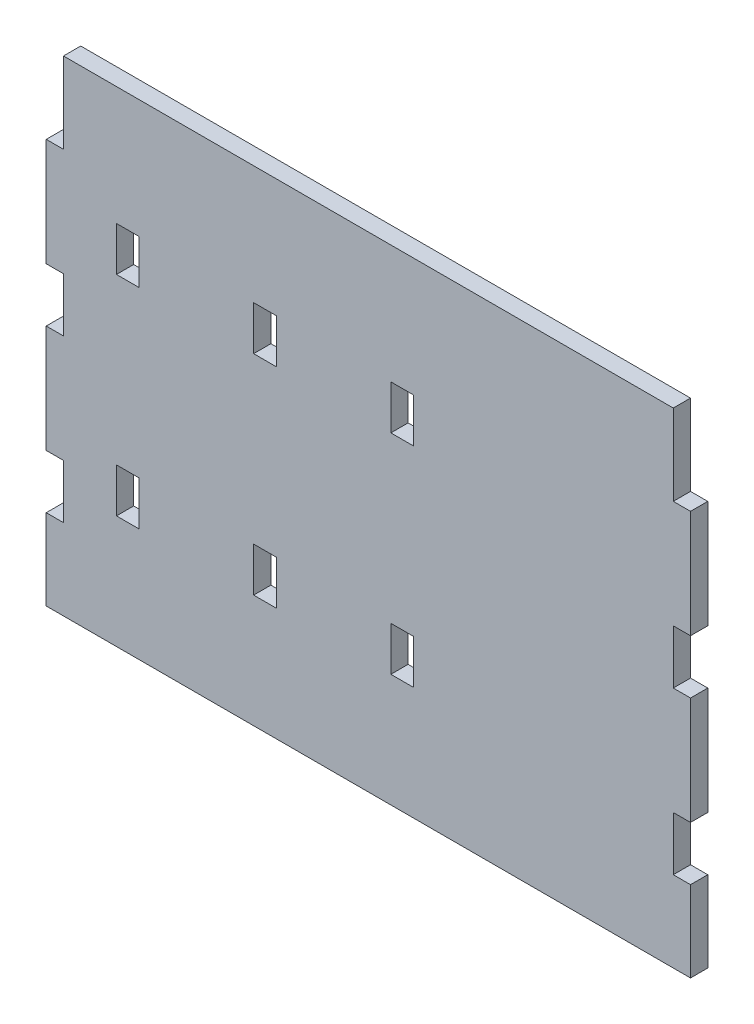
SolidWorks part; units mm, degrees
ref_plane "Front Plane" through (0, 0, 0) normal (0, 0, 1) x (1, 0, 0)
ref_plane "Top Plane" through (0, 0, 0) normal (0, 1, 0) x (1, 0, 0)
ref_plane "Right Plane" through (0, 0, 0) normal (1, 0, 0) x (0, 0, -1)
sketch "Sketch1" plane through (0, 0, 0) normal (0, 0, 1) x (1, 0, 0)
  line L0 (0, 550) -> (0, 475) construction
  line L2 (0, 100) -> (0, 550)
  line L3 (0, 550) -> (565.8, 550)
  line L4 (565.8, 100) -> (565.8, 550)
  line L5 (282.9, 550) -> (282.9, 100) construction
  line L6 (0, 375) -> (-16, 375)
  line L7 (450, 550) -> (450, 714.0497) construction
  line L8 (0, 475) -> (-16, 475)
  line L9 (-16, 375) -> (-16, 475)
  line L10 (-16, 175) -> (-16, 100)
  line L12 (0, 175) -> (0, 100)
  line L13 (0, 175) -> (-16, 175)
  line L14 (581.8, 225) -> (581.8, 325)
  line L15 (565.8, 325) -> (581.8, 325)
  line L16 (0, 225) -> (-16, 225)
  line L17 (0, 225) -> (0, 325)
  line L18 (0, 325) -> (-16, 325)
  line L19 (-16, 225) -> (-16, 325)
  line L20 (565.8, 225) -> (565.8, 325)
  line L21 (565.8, 225) -> (581.8, 225)
  line L22 (565.8, 175) -> (581.8, 175)
  line L23 (565.8, 175) -> (565.8, 100)
  line L25 (581.8, 175) -> (581.8, 100)
  line L26 (581.8, 375) -> (581.8, 475)
  line L27 (565.8, 475) -> (581.8, 475)
  line L28 (565.8, 375) -> (581.8, 375)
  line L30 (-16, 100) -> (581.8, 100)
extrude "Boss-Extrude1" add sketch "Sketch1" along normal blind 16
sketch "Sketch2" plane through (0, 0, 16) normal (0, 0, 1) x (1, 0, 0)
  line L0 (176.45, 399) -> (197.45, 399)
  line L1 (0, 431.9926) -> (49.15, 431.9926) construction
  line L2 (49.15, 399) -> (70.15, 399)
  line L3 (49.15, 399) -> (49.15, 440)
  line L4 (49.15, 440) -> (70.15, 440)
  line L5 (70.15, 399) -> (70.15, 440)
  line L6 (176.45, 399) -> (176.45, 440)
  line L7 (176.45, 440) -> (197.45, 440)
  line L8 (197.45, 399) -> (197.45, 440)
  line L9 (303.75, 399) -> (324.75, 399)
  line L10 (303.75, 399) -> (303.75, 440)
  line L11 (303.75, 440) -> (324.75, 440)
  line L12 (324.75, 399) -> (324.75, 440)
  line L13 (176.45, 205) -> (197.45, 205)
  line L14 (49.15, 205) -> (70.15, 205)
  line L15 (49.15, 205) -> (49.15, 246)
  line L16 (49.15, 246) -> (70.15, 246)
  line L17 (70.15, 205) -> (70.15, 246)
  line L18 (176.45, 205) -> (176.45, 246)
  line L19 (176.45, 246) -> (197.45, 246)
  line L20 (197.45, 205) -> (197.45, 246)
  line L21 (303.75, 205) -> (324.75, 205)
  line L22 (303.75, 205) -> (303.75, 246)
  line L23 (303.75, 246) -> (324.75, 246)
  line L24 (324.75, 205) -> (324.75, 246)
  dimension "D1" = 49.15
  dimension "D2" = 3
  dimension "D3" = 106.3
  dimension "D4" = 2
extrude "Cut-Extrude1" cut sketch "Sketch2" against normal blind 16
equation "\"thk\"= 16mm"
equation "\"D5@Sketch1\"=\"thk\""
equation "\"D7@Sketch1\"=\"thk\""
equation "\"D1\"= \"thk\""
equation "\"D1@Boss-Extrude1\"=\"thk\""
equation "\"D1@Cut-Extrude1\"=\"thk\""
